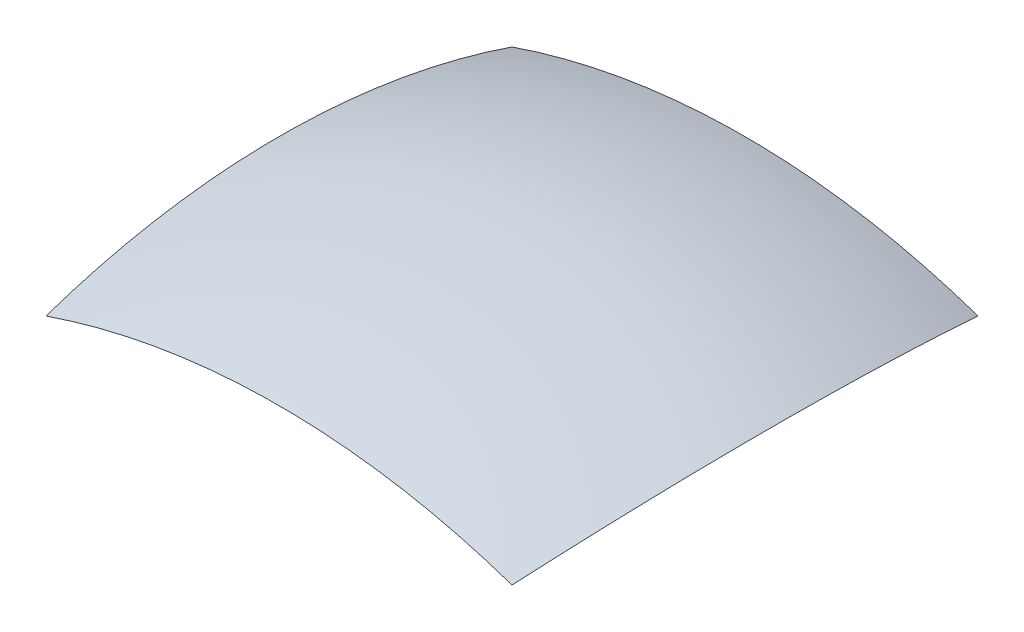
SolidWorks part; units mm, degrees
ref_plane "Front" through (0, 0, 0) normal (0, 0, 1) x (1, 0, 0)
ref_plane "Top" through (0, 0, 0) normal (0, 1, 0) x (1, 0, 0)
ref_plane "Right" through (0, 0, 0) normal (1, 0, 0) x (0, 0, -1)
sketch "Sketch1" plane through (0, 0, 0) normal (0, 0, 1) x (1, 0, 0)
  arc A0 (0, 0) -> (130, 0) centre (65, -189.1428) cw
  dimension "D2" = 200
  dimension "D1" = 130
sketch "Sketch2" plane through (0, 0, 0) normal (1, 0, 0) x (0, 0, -1)
  arc A0 (0, 0) -> (130, 0) centre (65, -189.1428) cw
  dimension "D1" = 200
  dimension "D2" = 130
surface "Surface-Sweep3"
